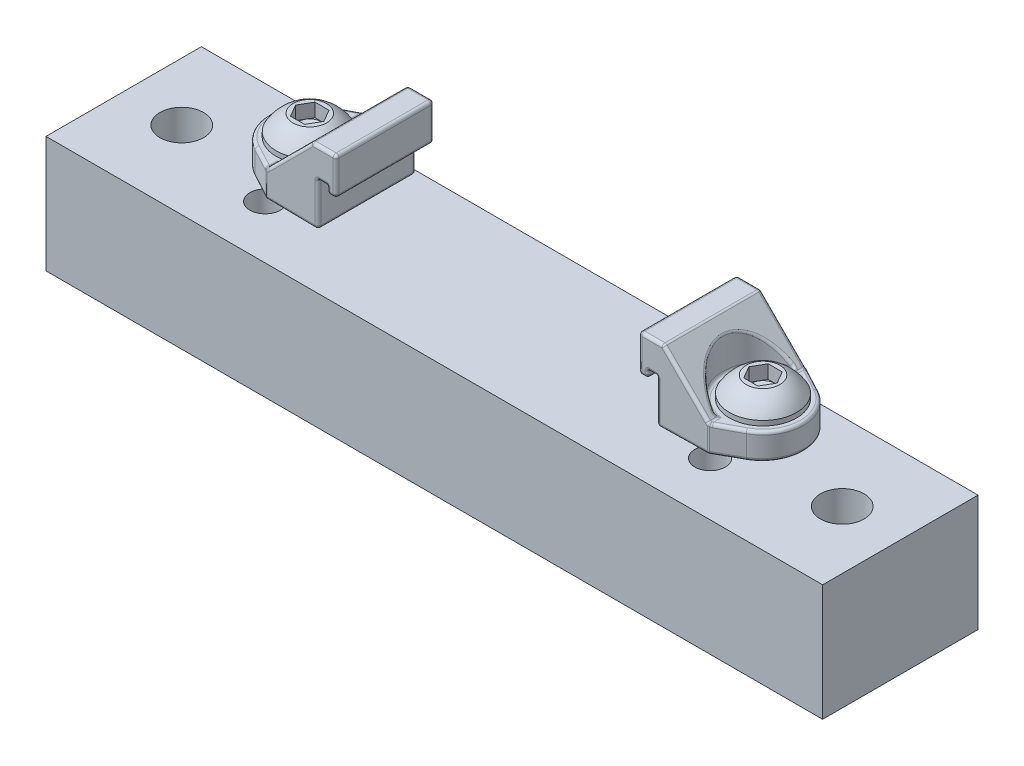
SolidWorks part; units mm, degrees
other "<81321050>-<Fillet1>"
other "<81321050>-<Fillet1>"
other "<27501049>-<Hex>"
other "<27501049>-<Hex>"
ref_plane "Front" through (0, 0, 0) normal (0, 0, 1) x (1, 0, 0)
ref_plane "Top" through (0, 0, 0) normal (0, 1, 0) x (1, 0, 0)
ref_plane "Right" through (0, 0, 0) normal (1, 0, 0) x (0, 0, -1)
imported_body "Imported1"
inserted part "81321050"
move or copy body "Body-Move/Copy2" placed by mates yes
other "Distance1" parameters "D1"=12.2
inserted part "813210502"
move or copy body "Body-Move/Copy4" placed by mates yes
inserted part "27501049"
move or copy body "Body-Move/Copy6" placed by mates yes
inserted part "275010492"
move or copy body "Body-Move/Copy8" placed by mates yes
inserted part "813210503"
move or copy body "Body-Move/Copy10"
other "Distance2" [suppressed] parameters "D1"=12.2
inserted part "813210504"
move or copy body "Body-Move/Copy12"
inserted part "275010493"
move or copy body "Body-Move/Copy14"
inserted part "275010494"
move or copy body "Body-Move/Copy16"
